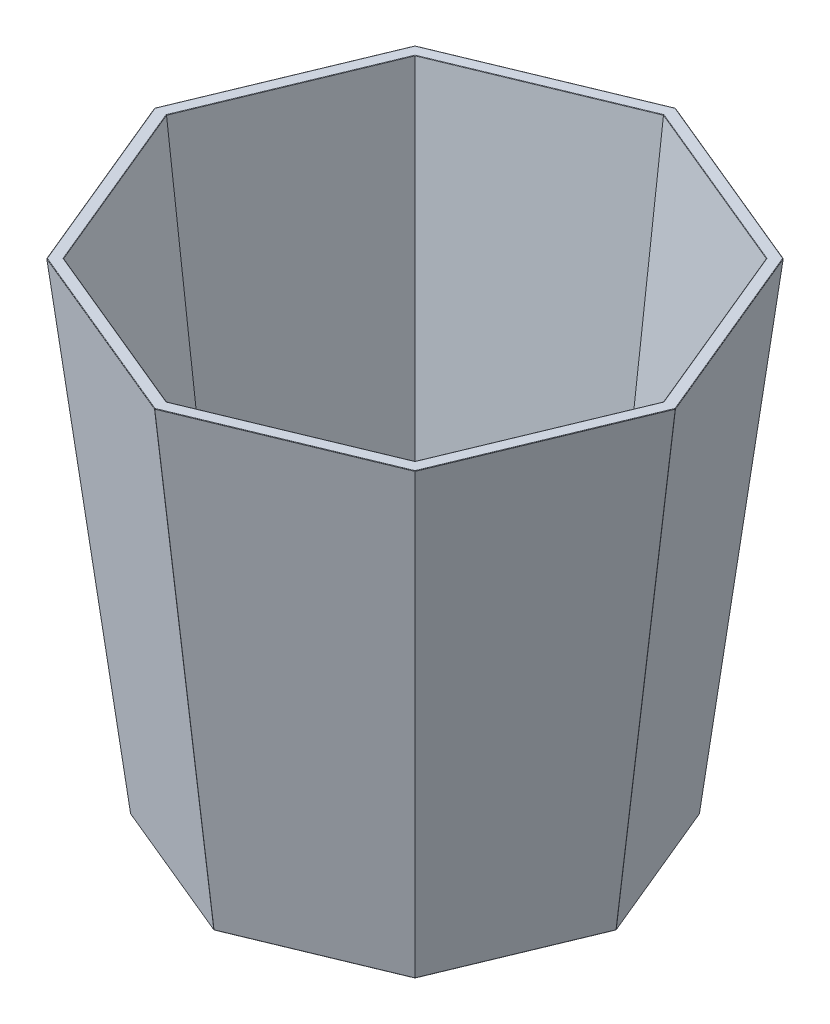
SolidWorks part; units mm, degrees
ref_plane "Front Plane" through (0, 0, 0) normal (0, 0, 1) x (1, 0, 0)
ref_plane "Top Plane" through (0, 0, 0) normal (0, 1, 0) x (1, 0, 0)
ref_plane "Right Plane" through (0, 0, 0) normal (1, 0, 0) x (0, 0, -1)
sketch "Sketch1" plane through (0, 0, 0) normal (0, 1, 0) x (1, 0, 0)
  line L0 (0, -59.5316) -> (42.0952, -42.0952)
  line L1 (59.5316, 0) -> (42.0952, 42.0952)
  line L2 (42.0952, 42.0952) -> (0, 59.5316)
  line L3 (0, 59.5316) -> (-42.0952, 42.0952)
  line L4 (-42.0952, 42.0952) -> (-59.5316, 0)
  line L5 (-59.5316, 0) -> (-42.0952, -42.0952)
  line L6 (-42.0952, -42.0952) -> (0, -59.5316)
  line L7 (42.0952, -42.0952) -> (59.5316, 0)
  circle A0 centre (0, 0) radius 55 construction
  dimension "D1" = 110
extrude "Boss-Extrude1" add sketch "Sketch1" against normal blind 110 draft 6.5
shell "Shell1" thickness 2.5
sketch "Sketch3" plane through (0, -107.5, 0) normal (0, 1, 0) x (1, 0, 0)
  circle A0 centre (0, 0) radius 30
extrude "Cut-Extrude1" cut sketch "Sketch3" against normal blind 110
sketch "Sketch5" plane through (0, -110, 0) normal (0, -1, 0) x (1, 0, 0)
  line L1 (0, -46.0017) -> (32.5281, -32.5281)
  line L2 (32.5281, -32.5281) -> (46.0017, 0)
  line L3 (46.0017, 0) -> (32.5281, 32.5281)
  line L4 (32.5281, 32.5281) -> (0, 46.0017)
  line L5 (0, 46.0017) -> (-32.5281, 32.5281)
  line L6 (-32.5281, 32.5281) -> (-46.0017, 0)
  line L7 (-46.0017, 0) -> (-32.5281, -32.5281)
  line L8 (-32.5281, -32.5281) -> (0, -46.0017)
  circle A0 centre (0, 0) radius 42.5 construction
  dimension "D1" = 85
fillet "Fillet3" radius 0.1 33 edges at (37.299, -55, 37.299) (0, -55, 52.7488) (-37.299, -55, 37.299) (-52.7488, -55, 0) (-37.299, -55, -37.299) (0, -55, -52.7488) (37.299, -55, -37.299) (52.7488, -55, 0) (39.2345, -110, -16.2514) (16.2514, -110, -39.2345) (-16.2514, -110, -39.2345) (-39.2345, -110, -16.2514) (-39.2345, -110, 16.2514) (-16.2514, -110, 39.2345) (16.2514, -110, 39.2345) (39.2345, -110, 16.2514) (0, -110, 30) (21.0476, 0, 50.8134) (-21.0476, 0, 50.8134) (-50.8134, 0, 21.0476) (-50.8134, 0, -21.0476) (-21.0476, 0, -50.8134) (21.0476, 0, -50.8134) (50.8134, 0, -21.0476) (50.8134, 0, 21.0476) (48.4887, 0, -20.0847) (20.0847, 0, -48.4887) (-20.0847, 0, -48.4887) (-48.4887, 0, -20.0847) (-48.4887, 0, 20.0847) (-20.0847, 0, 48.4887) (20.0847, 0, 48.4887) (48.4887, 0, 20.0847)
